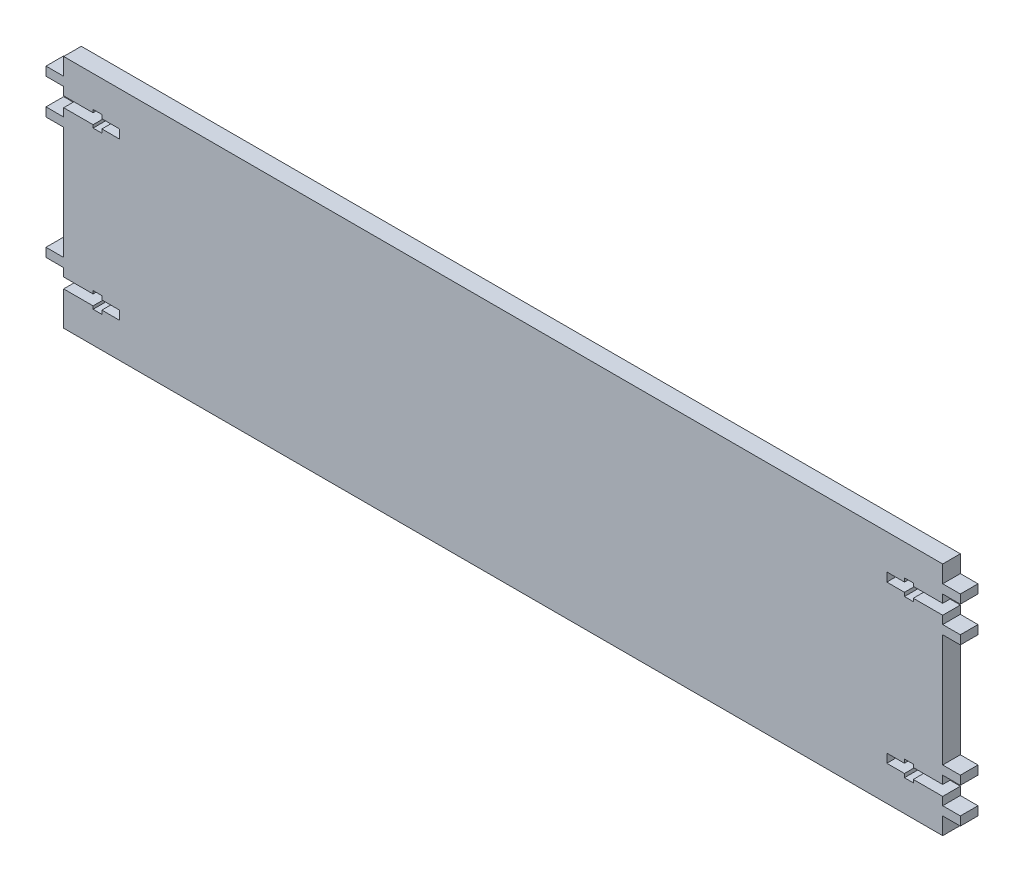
SolidWorks part; units mm, degrees
ref_plane "Front Plane" through (0, 0, 0) normal (0, 0, 1) x (1, 0, 0)
ref_plane "Top Plane" through (0, 0, 0) normal (0, 1, 0) x (1, 0, 0)
ref_plane "Right Plane" through (0, 0, 0) normal (1, 0, 0) x (0, 0, -1)
sketch "Sketch1" plane through (0, 0, 0) normal (0, 0, 1) x (1, 0, 0)
  line L1 (149.4, -40) -> (-149.4, -40)
  line L2 (149.4, -40) -> (149.4, 40)
  line L3 (149.4, 40) -> (-149.4, 40)
  line L4 (-149.4, -40) -> (-149.4, 40)
  line L5 (149.4, -40) -> (-149.4, 40) construction
  line L6 (149.4, 40) -> (-149.4, -40) construction
  point P0 (0, 0)
  dimension "D1" = 298.8
  dimension "D2" = 80
extrude "Boss-Extrude1" add sketch "Sketch1" along normal mid plane 6
sketch "Sketch2" plane through (0, 0, 3) normal (0, 0, 1) x (1, 0, 0)
  line L0 (0, 0) -> (0, 40)
  line L1 (149.4, 40) -> (-149.4, 40) construction
  line L2 (-149.4, 0) -> (0, 0) construction
  line L3 (-149.4, 40) -> (-149.4, -40) construction
  line L4 (149.4, 40) -> (155.4, 40) construction
  line L5 (155.4, 40) -> (155.4, -40) construction
  line L6 (155.4, -40) -> (149.4, -40) construction
  line L7 (155.4, 26.6667) -> (149.4, 26.6667) construction
  line L8 (149.4, -40) -> (149.4, 40) construction
  line L9 (149.4, 22.1667) -> (155.4, 22.1667)
  line L10 (149.4, 34.1667) -> (155.4, 34.1667)
  line L11 (149.4, 34.1667) -> (149.4, 31.1667)
  line L12 (149.4, 31.1667) -> (155.4, 31.1667)
  line L13 (155.4, 34.1667) -> (155.4, 31.1667)
  line L14 (155.4, 19.1667) -> (155.4, 22.1667)
  line L15 (149.4, 19.1667) -> (155.4, 19.1667)
  line L16 (149.4, 19.1667) -> (149.4, 22.1667)
  line L17 (149.4, -19.1667) -> (149.4, -22.1667)
  line L18 (149.4, -19.1667) -> (155.4, -19.1667)
  line L19 (155.4, -19.1667) -> (155.4, -22.1667)
  line L20 (149.4, -22.1667) -> (155.4, -22.1667)
  line L21 (149.4, -31.1667) -> (155.4, -31.1667)
  line L22 (155.4, -34.1667) -> (155.4, -31.1667)
  line L23 (149.4, -34.1667) -> (155.4, -34.1667)
  line L24 (149.4, -34.1667) -> (149.4, -31.1667)
  line L25 (-149.4, 19.1667) -> (-149.4, 22.1667)
  line L26 (-149.4, 19.1667) -> (-155.4, 19.1667)
  line L27 (-155.4, 19.1667) -> (-155.4, 22.1667)
  line L28 (-149.4, 22.1667) -> (-155.4, 22.1667)
  line L29 (-149.4, 31.1667) -> (-155.4, 31.1667)
  line L30 (-155.4, 34.1667) -> (-155.4, 31.1667)
  line L31 (-149.4, 34.1667) -> (-155.4, 34.1667)
  line L32 (-149.4, 34.1667) -> (-149.4, 31.1667)
  line L33 (-149.4, -34.1667) -> (-149.4, -31.1667)
  line L34 (-149.4, -34.1667) -> (-155.4, -34.1667)
  line L35 (-155.4, -34.1667) -> (-155.4, -31.1667)
  line L36 (-149.4, -31.1667) -> (-155.4, -31.1667)
  line L37 (-149.4, -19.1667) -> (-155.4, -19.1667)
  line L38 (-155.4, -19.1667) -> (-155.4, -22.1667)
  line L39 (-149.4, -22.1667) -> (-155.4, -22.1667)
  line L40 (-149.4, -19.1667) -> (-149.4, -22.1667)
  point P22 (155.4, 32.6667)
extrude "Boss-Extrude3" add sketch "Sketch2" against normal up to surface (6 mm away) contours L31 L30 L29 M22 | L28 L27 L26 M22 | L39 L37 L38 M22 | L13 L10 L12 M24 | L15 L14 L9 M24 | L20 L19 L18 M24 | L23 L22 L21 M24
sketch "Sketch4" plane through (0, 0, 3) normal (0, 0, 1) x (1, 0, 0)
  line L0 (0, 40) -> (0, 0) construction
  line L1 (149.4, 40) -> (-149.4, 40) construction
  line L2 (0, 0) -> (149.4, 0) construction
  line L3 (149.4, -19.1667) -> (149.4, 19.1667) construction
  line L4 (149.4, 31.1667) -> (149.4, 22.1667) construction
  line L5 (149.4, 22.1667) -> (149.4, -22.1667) construction
  line L6 (149.4, -22.1667) -> (149.4, -31.1667) construction
  line L7 (139.4, 24.9167) -> (139.4, 23.9108)
  line L8 (139.4, 28.4167) -> (149.4, 28.4167)
  line L10 (139.4, 24.9167) -> (149.4, 24.9167)
  line L11 (149.4, 28.4167) -> (149.4, 24.9167)
  line L12 (136.4, 29.4226) -> (139.4, 29.4226)
  line L13 (136.4, 29.4226) -> (136.4, 28.1667)
  line L14 (136.4, 23.9108) -> (139.4, 23.9108)
  line L15 (139.4, 29.4226) -> (139.4, 28.4167)
  line L16 (130.4, 28.1667) -> (136.4, 28.1667)
  line L17 (130.4, 28.1667) -> (130.4, 25.1667)
  line L18 (130.4, 25.1667) -> (136.4, 25.1667)
  line L20 (136.4, 25.1667) -> (136.4, 23.9108)
  line L21 (130.4, 26.6667) -> (149.4, 26.6667) construction
  line L22 (136.4, -29.4226) -> (136.4, -28.1667)
  line L23 (130.4, -28.1667) -> (136.4, -28.1667)
  line L24 (130.4, -28.1667) -> (130.4, -25.1667)
  line L25 (130.4, -25.1667) -> (136.4, -25.1667)
  line L26 (136.4, -25.1667) -> (136.4, -23.9108)
  line L27 (136.4, -23.9108) -> (139.4, -23.9108)
  line L28 (139.4, -24.9167) -> (139.4, -23.9108)
  line L29 (139.4, -24.9167) -> (149.4, -24.9167)
  line L30 (149.4, -28.4167) -> (149.4, -24.9167)
  line L31 (139.4, -28.4167) -> (149.4, -28.4167)
  line L32 (139.4, -29.4226) -> (139.4, -28.4167)
  line L33 (136.4, -29.4226) -> (139.4, -29.4226)
  line L34 (-136.4, -29.4226) -> (-139.4, -29.4226)
  line L35 (-139.4, -29.4226) -> (-139.4, -28.4167)
  line L36 (-139.4, -28.4167) -> (-149.4, -28.4167)
  line L37 (-149.4, -28.4167) -> (-149.4, -24.9167)
  line L38 (-139.4, -24.9167) -> (-149.4, -24.9167)
  line L39 (-139.4, -24.9167) -> (-139.4, -23.9108)
  line L40 (-136.4, -23.9108) -> (-139.4, -23.9108)
  line L41 (-136.4, -25.1667) -> (-136.4, -23.9108)
  line L42 (-130.4, -25.1667) -> (-136.4, -25.1667)
  line L43 (-130.4, -28.1667) -> (-130.4, -25.1667)
  line L44 (-130.4, -28.1667) -> (-136.4, -28.1667)
  line L45 (-136.4, -29.4226) -> (-136.4, -28.1667)
  line L46 (-136.4, 29.4226) -> (-136.4, 28.1667)
  line L47 (-130.4, 28.1667) -> (-136.4, 28.1667)
  line L48 (-130.4, 28.1667) -> (-130.4, 25.1667)
  line L49 (-130.4, 25.1667) -> (-136.4, 25.1667)
  line L50 (-136.4, 25.1667) -> (-136.4, 23.9108)
  line L51 (-136.4, 23.9108) -> (-139.4, 23.9108)
  line L52 (-139.4, 24.9167) -> (-139.4, 23.9108)
  line L53 (-139.4, 24.9167) -> (-149.4, 24.9167)
  line L54 (-149.4, 28.4167) -> (-149.4, 24.9167)
  line L55 (-139.4, 28.4167) -> (-149.4, 28.4167)
  line L56 (-139.4, 29.4226) -> (-139.4, 28.4167)
  line L57 (-136.4, 29.4226) -> (-139.4, 29.4226)
  line L58 (155.4, 31.1667) -> (155.4, 34.1667) construction
  point P30 (149.4, 26.6667)
  dimension "D1" = 3
  dimension "D2" = 25
  dimension "D3" = 3
  dimension "D4" = 5.5118
  dimension "D5" = 3.5
  dimension "D6" = 10
extrude "Cut-Extrude1" cut sketch "Sketch4" against normal through all
sketch "Sketch5" [suppressed] plane through (0, 0, 3) normal (0, 0, 1) x (1, 0, 0)
  line L0 (103.4598, 0) -> (-103.4598, 0) construction
  line L1 (-103.4598, 0) -> (-103.4598, -25.4098) construction
  line L2 (-103.4598, -25.4098) -> (-53.2233, -25.4098) construction
  line L3 (103.4598, 0) -> (103.4598, 21.5012) construction
  line L4 (103.4598, 21.5012) -> (65.08, 21.5012) construction
  line L5 (-106.8599, -20.8535) -> (-6.8599, -20.8535) construction
  line L6 (-106.8599, -12.832) -> (-106.8599, -28.8751) construction
  line L7 (-106.8599, -28.8751) -> (-6.8599, -28.8751) construction
  spline S41 degree 3 poles (-110.4424, -23.253) (-110.8115, -24.1562) (-111.4476, -24.8662) (-112.4127, -25.189) knots 7 7 7 7 8 8 8 8
  spline S42 degree 3 poles (-109.9657, -16.6792) (-111.6642, -15.6576) (-113.3896, -14.6793) (-115.1231, -13.7177) knots 2 2 2 2 3 3 3 3
  spline S43 degree 3 poles (-112.4127, -25.189) (-113.4, -25.519) (-114.188, -25.0436) (-114.3863, -24.0234) knots 8 8 8 8 9 9 9 9
  spline S44 degree 3 poles (-109.095, -23.8658) (-109.1369, -23.3168) (-109.1046, -22.7618) (-109.1046, -22.1295) knots 5 5 5 5 6 6 6 6
  spline S45 degree 3 poles (-115.1439, -28.8751) (-115.3462, -28.3496) (-115.2144, -28.037) (-114.7246, -27.7655) knots 2 2 2 2 3 3 3 3
  spline S46 degree 3 poles (-117.6442, -14.6795) (-117.1502, -15.0664) (-116.7191, -15.2634) (-116.1289, -15.1792) knots 5 5 5 5 6 6 6 6
  spline S47 degree 3 poles (-116.6979, -24.255) (-116.7618, -24.4751) (-116.8679, -24.7463) (-117.042, -24.8602) knots 10 10 10 10 11 11 11 11
  spline S48 degree 3 poles (-118.5425, -16.9452) (-118.6749, -16.4107) (-119.5806, -15.8104) (-120.0708, -16.073) knots 10 10 10 10 11 11 11 11
  spline S49 degree 3 poles (-109.1074, -19.3488) (-109.0921, -18.9392) (-109.071, -18.5252) (-109.1129, -18.1195) knots 12 12 12 12 13 13 13 13
  spline S50 degree 3 poles (-109.6631, -24.8854) (-109.2152, -24.6385) (-109.0576, -24.3573) (-109.095, -23.8658) knots 4 4 4 4 5 5 5 5
  spline S51 degree 3 poles (-122.3832, -24.9877) (-123.9049, -22.4692) (-123.8961, -19.8451) (-122.6854, -17.1803) knots 1 1 1 1 2 2 2 2
  spline S52 degree 3 poles (-108.7616, -16.5421) (-109.1199, -16.9739) (-109.4701, -16.9772) (-109.9657, -16.6792) knots 1 1 1 1 2 2 2 2
  spline S53 degree 3 poles (-122.3022, -16.5627) (-119.3848, -11.6974) (-111.944, -11.4704) (-108.7616, -16.5421) knots 0 0 0 0 1 1 1 1
  spline S54 degree 3 poles (-108.3819, -17.1376) (-107.1983, -19.5706) (-107.1139, -22.0328) (-108.3544, -24.4577) knots 0 0 0 0 1 1 1 1
  spline S55 degree 3 poles (-117.042, -24.8602) (-117.9014, -25.4231) (-117.573, -26.2812) (-117.4705, -26.9704) knots 11 11 11 11 12 12 12 12
  spline S56 degree 3 poles (-108.3544, -24.4577) (-109.7557, -27.1973) (-112.076, -28.6099) (-115.1439, -28.8751) knots 1 1 1 1 2 2 2 2
  spline S57 degree 3 poles (-110.746, -20.2596) (-110.2245, -20.444) (-109.1284, -19.9091) (-109.1074, -19.3488) knots 11 11 11 11 12 12 12 12
  spline S58 degree 3 poles (-119.9695, -25.7204) (-119.9853, -24.9556) (-119.888, -24.3565) (-120.242, -23.6989) knots 6 6 6 6 7 7 7 7
  spline S59 degree 3 poles (-117.8496, -18.2452) (-118.2004, -17.9441) (-118.4265, -17.4128) (-118.5425, -16.9452) knots 9 9 9 9 10 10 10 10
  spline S60 degree 3 poles (-115.1231, -13.7177) (-115.3321, -13.6017) (-115.6958, -13.5965) (-115.9142, -13.6981) knots 3 3 3 3 4 4 4 4
  spline S61 degree 3 poles (-112.0987, -20.1458) (-111.6864, -20.0298) (-111.1631, -20.1119) (-110.746, -20.2596) knots 10 10 10 10 11 11 11 11
  spline S62 degree 3 poles (-115.9705, -28.8144) (-118.7657, -28.6023) (-120.945, -27.3678) (-122.3832, -24.9877) knots 0 0 0 0 1 1 1 1
  spline S63 degree 3 poles (-120.832, -21.5054) (-120.8393, -20.3362) (-119.8917, -19.8071) (-118.7897, -20.211) knots 8 8 8 8 9 9 9 9
  spline S64 degree 3 poles (-121.3563, -24.9511) (-120.9106, -25.1443) (-120.5011, -25.4207) (-119.9695, -25.7204) knots 5 5 5 5 6 6 6 6
  spline S65 degree 3 poles (-116.3389, -27.8095) (-115.9382, -28.0299) (-115.7489, -28.2784) (-115.9705, -28.8144) knots 13 13 13 13 14 14 14 14
  spline S66 degree 3 poles (-122.0137, -23.8494) (-122.0233, -24.3989) (-121.866, -24.7305) (-121.3563, -24.9511) knots 4 4 4 4 5 5 5 5
  spline S67 degree 3 poles (-113.5978, -18.2899) (-114.7196, -19.1239) (-116.7937, -19.1513) (-117.8496, -18.2452) knots 8 8 8 8 9 9 9 9
  spline S68 degree 3 poles (-118.7897, -20.211) (-117.3585, -20.7356) (-116.2774, -22.8087) (-116.6979, -24.255) knots 9 9 9 9 10 10 10 10
  spline S69 degree 3 poles (-121.9892, -18.0877) (-122.0181, -20.0081) (-121.9805, -21.9292) (-122.0137, -23.8494) knots 3 3 3 3 4 4 4 4
  spline S70 degree 3 poles (-113.6045, -15.7537) (-112.6249, -16.4598) (-112.6283, -17.569) (-113.5978, -18.2899) knots 7 7 7 7 8 8 8 8
  spline S71 degree 3 poles (-115.9142, -13.6981) (-116.4919, -13.967) (-117.0293, -14.3228) (-117.6442, -14.6795) knots 4 4 4 4 5 5 5 5
  spline S72 degree 3 poles (-109.1046, -22.1295) (-109.7299, -22.3996) (-110.1907, -22.6368) (-110.4424, -23.253) knots 6 6 6 6 7 7 7 7
  spline S73 degree 3 poles (-117.4705, -26.9704) (-117.4212, -27.3022) (-116.7606, -27.5776) (-116.3389, -27.8095) knots 12 12 12 12 13 13 13 13
  spline S74 degree 3 poles (-114.7246, -27.7655) (-113.0269, -26.8247) (-111.3631, -25.8218) (-109.6631, -24.8854) knots 3 3 3 3 4 4 4 4
  spline S75 degree 3 poles (-121.0777, -16.654) (-121.5327, -16.9952) (-121.9237, -16.9995) (-122.3022, -16.5627) knots 12 12 12 12 13 13 13 13
  spline S76 degree 3 poles (-116.1289, -15.1792) (-115.2318, -15.0511) (-114.3602, -15.2091) (-113.6045, -15.7537) knots 6 6 6 6 7 7 7 7
  spline S77 degree 3 poles (-120.242, -23.6989) (-120.5941, -23.0451) (-120.8275, -22.2439) (-120.832, -21.5054) knots 7 7 7 7 8 8 8 8
  spline S78 degree 3 poles (-120.0708, -16.073) (-120.4127, -16.2562) (-120.7699, -16.4233) (-121.0777, -16.654) knots 11 11 11 11 12 12 12 12
  spline S79 degree 3 poles (-109.1129, -18.1195) (-109.1686, -17.5817) (-108.9921, -17.2486) (-108.3819, -17.1376) knots 13 13 13 13 14 14 14 14
  spline S80 degree 3 poles (-114.3863, -24.0234) (-114.671, -22.5599) (-113.5274, -20.5478) (-112.0987, -20.1458) knots 9 9 9 9 10 10 10 10
  spline S81 degree 3 poles (-122.6854, -17.1803) (-122.1285, -17.2776) (-121.9814, -17.5734) (-121.9892, -18.0877) knots 2 2 2 2 3 3 3 3
  text T0 "Fab-Lapse" font "Freestyle Script" height in points 72
  text T1 "FABLAB" font "Arial Narrow" height 10
  text T2 "QUERÉTARO" font "Arial Narrow" height 5
  dimension "D1" = 100
  dimension "D2" = 100
extrude "Cut-Extrude2" [suppressed] cut sketch "Sketch5" against normal blind 0.1
sketch "Sketch6" plane through (0, 0, -3) normal (0, 0, -1) x (-1, 0, 0)
  line L0 (98.8719, 0) -> (-98.8719, 0) construction
  line L1 (-98.8719, 0) -> (-98.8719, -27.6506) construction
  line L2 (-98.8719, -27.6506) -> (-65.9146, -27.6506) construction
  line L3 (98.8719, 0) -> (98.8719, 30.4436) construction
  line L4 (98.8719, 30.4436) -> (64.2388, 30.4436) construction
  line L5 (-110.8044, -33.1882) -> (-57.1679, -33.1882) construction
  line L6 (-110.8044, -25.1667) -> (-10.8044, -25.1667) construction
  line L7 (-110.8044, -17.1451) -> (-110.8044, -33.1882) construction
  spline S0 degree 3 poles (-114.387, -27.5662) (-114.7561, -28.4694) (-115.3922, -29.1793) (-116.3573, -29.5022) knots 7 7 7 7 8 8 8 8
  spline S1 degree 3 poles (-113.9102, -20.9923) (-115.6088, -19.9708) (-117.3341, -18.9925) (-119.0677, -18.0308) knots 2 2 2 2 3 3 3 3
  spline S2 degree 3 poles (-116.3573, -29.5022) (-117.3446, -29.8322) (-118.1326, -29.3567) (-118.3309, -28.3365) knots 8 8 8 8 9 9 9 9
  spline S3 degree 3 poles (-113.0396, -28.1789) (-113.0815, -27.6299) (-113.0492, -27.0749) (-113.0492, -26.4426) knots 5 5 5 5 6 6 6 6
  spline S4 degree 3 poles (-119.0885, -33.1882) (-119.2907, -32.6627) (-119.159, -32.3501) (-118.6692, -32.0787) knots 2 2 2 2 3 3 3 3
  spline S5 degree 3 poles (-121.5888, -18.9926) (-121.0947, -19.3795) (-120.6637, -19.5765) (-120.0735, -19.4923) knots 5 5 5 5 6 6 6 6
  spline S6 degree 3 poles (-120.6425, -28.5682) (-120.7064, -28.7882) (-120.8125, -29.0594) (-120.9865, -29.1733) knots 10 10 10 10 11 11 11 11
  spline S7 degree 3 poles (-122.4871, -21.2584) (-122.6195, -20.7239) (-123.5252, -20.1235) (-124.0154, -20.3861) knots 10 10 10 10 11 11 11 11
  spline S8 degree 3 poles (-113.052, -23.6619) (-113.0367, -23.2524) (-113.0156, -22.8383) (-113.0575, -22.4326) knots 12 12 12 12 13 13 13 13
  spline S9 degree 3 poles (-113.6077, -29.1986) (-113.1598, -28.9516) (-113.0022, -28.6704) (-113.0396, -28.1789) knots 4 4 4 4 5 5 5 5
  spline S10 degree 3 poles (-126.3278, -29.3008) (-127.8495, -26.7824) (-127.8407, -24.1582) (-126.6299, -21.4934) knots 1 1 1 1 2 2 2 2
  spline S11 degree 3 poles (-112.7062, -20.8553) (-113.0645, -21.2871) (-113.4146, -21.2904) (-113.9102, -20.9923) knots 1 1 1 1 2 2 2 2
  spline S12 degree 3 poles (-126.2467, -20.8758) (-123.3294, -16.0106) (-115.8886, -15.7835) (-112.7062, -20.8553) knots 0 0 0 0 1 1 1 1
  spline S13 degree 3 poles (-112.3264, -21.4507) (-111.1428, -23.8837) (-111.0585, -26.3459) (-112.299, -28.7709) knots 0 0 0 0 1 1 1 1
  spline S14 degree 3 poles (-120.9865, -29.1733) (-121.846, -29.7362) (-121.5176, -30.5944) (-121.4151, -31.2835) knots 11 11 11 11 12 12 12 12
  spline S15 degree 3 poles (-112.299, -28.7709) (-113.7003, -31.5104) (-116.0206, -32.9231) (-119.0885, -33.1882) knots 1 1 1 1 2 2 2 2
  spline S16 degree 3 poles (-114.6906, -24.5728) (-114.169, -24.7571) (-113.073, -24.2223) (-113.052, -23.6619) knots 11 11 11 11 12 12 12 12
  spline S17 degree 3 poles (-123.9141, -30.0335) (-123.9299, -29.2687) (-123.8326, -28.6697) (-124.1866, -28.0121) knots 6 6 6 6 7 7 7 7
  spline S18 degree 3 poles (-121.7942, -22.5583) (-122.145, -22.2572) (-122.3711, -21.7259) (-122.4871, -21.2584) knots 9 9 9 9 10 10 10 10
  spline S19 degree 3 poles (-119.0677, -18.0308) (-119.2766, -17.9148) (-119.6403, -17.9097) (-119.8588, -18.0113) knots 3 3 3 3 4 4 4 4
  spline S20 degree 3 poles (-116.0433, -24.4589) (-115.631, -24.3429) (-115.1077, -24.425) (-114.6906, -24.5728) knots 10 10 10 10 11 11 11 11
  spline S21 degree 3 poles (-119.9151, -33.1276) (-122.7103, -32.9154) (-124.8896, -31.681) (-126.3278, -29.3008) knots 0 0 0 0 1 1 1 1
  spline S22 degree 3 poles (-124.7765, -25.8186) (-124.7839, -24.6493) (-123.8363, -24.1202) (-122.7343, -24.5241) knots 8 8 8 8 9 9 9 9
  spline S23 degree 3 poles (-125.3009, -29.2642) (-124.8552, -29.4574) (-124.4456, -29.7339) (-123.9141, -30.0335) knots 5 5 5 5 6 6 6 6
  spline S24 degree 3 poles (-120.2835, -32.1227) (-119.8828, -32.343) (-119.6934, -32.5915) (-119.9151, -33.1276) knots 13 13 13 13 14 14 14 14
  spline S25 degree 3 poles (-125.9583, -28.1626) (-125.9679, -28.7121) (-125.8106, -29.0436) (-125.3009, -29.2642) knots 4 4 4 4 5 5 5 5
  spline S26 degree 3 poles (-117.5424, -22.603) (-118.6641, -23.437) (-120.7383, -23.4644) (-121.7942, -22.5583) knots 8 8 8 8 9 9 9 9
  spline S27 degree 3 poles (-122.7343, -24.5241) (-121.3031, -25.0487) (-120.222, -27.1218) (-120.6425, -28.5682) knots 9 9 9 9 10 10 10 10
  spline S28 degree 3 poles (-125.9338, -22.4008) (-125.9626, -24.3212) (-125.9251, -26.2423) (-125.9583, -28.1626) knots 3 3 3 3 4 4 4 4
  spline S29 degree 3 poles (-117.5491, -20.0669) (-116.5695, -20.7729) (-116.5729, -21.8822) (-117.5424, -22.603) knots 7 7 7 7 8 8 8 8
  spline S30 degree 3 poles (-119.8588, -18.0113) (-120.4365, -18.2801) (-120.9739, -18.6359) (-121.5888, -18.9926) knots 4 4 4 4 5 5 5 5
  spline S31 degree 3 poles (-113.0492, -26.4426) (-113.6745, -26.7128) (-114.1353, -26.95) (-114.387, -27.5662) knots 6 6 6 6 7 7 7 7
  spline S32 degree 3 poles (-121.4151, -31.2835) (-121.3658, -31.6153) (-120.7052, -31.8908) (-120.2835, -32.1227) knots 12 12 12 12 13 13 13 13
  spline S33 degree 3 poles (-118.6692, -32.0787) (-116.9715, -31.1378) (-115.3077, -30.135) (-113.6077, -29.1986) knots 3 3 3 3 4 4 4 4
  spline S34 degree 3 poles (-125.0223, -20.9671) (-125.4773, -21.3083) (-125.8683, -21.3126) (-126.2467, -20.8758) knots 12 12 12 12 13 13 13 13
  spline S35 degree 3 poles (-120.0735, -19.4923) (-119.1764, -19.3642) (-118.3048, -19.5222) (-117.5491, -20.0669) knots 6 6 6 6 7 7 7 7
  spline S36 degree 3 poles (-124.1866, -28.0121) (-124.5387, -27.3582) (-124.7721, -26.557) (-124.7765, -25.8186) knots 7 7 7 7 8 8 8 8
  spline S37 degree 3 poles (-124.0154, -20.3861) (-124.3572, -20.5693) (-124.7145, -20.7364) (-125.0223, -20.9671) knots 11 11 11 11 12 12 12 12
  spline S38 degree 3 poles (-113.0575, -22.4326) (-113.1131, -21.8948) (-112.9367, -21.5617) (-112.3264, -21.4507) knots 13 13 13 13 14 14 14 14
  spline S39 degree 3 poles (-118.3309, -28.3365) (-118.6155, -26.873) (-117.472, -24.861) (-116.0433, -24.4589) knots 9 9 9 9 10 10 10 10
  spline S40 degree 3 poles (-126.6299, -21.4934) (-126.0731, -21.5907) (-125.926, -21.8865) (-125.9338, -22.4008) knots 2 2 2 2 3 3 3 3
  text T0 "Fab-Lapse" font "Freestyle Script" height in points 72
  text T1 "FABLAB" font "Arial Narrow" height 10
  text T2 "QUERÉTARO" font "Arial Narrow" height 5
  point P4 (0, 0)
extrude "Cut-Extrude3" cut sketch "Sketch6" against normal blind 0.1
equation "\"D3@Sketch2\"=(\"D2@Sketch2\"/3)/2"
